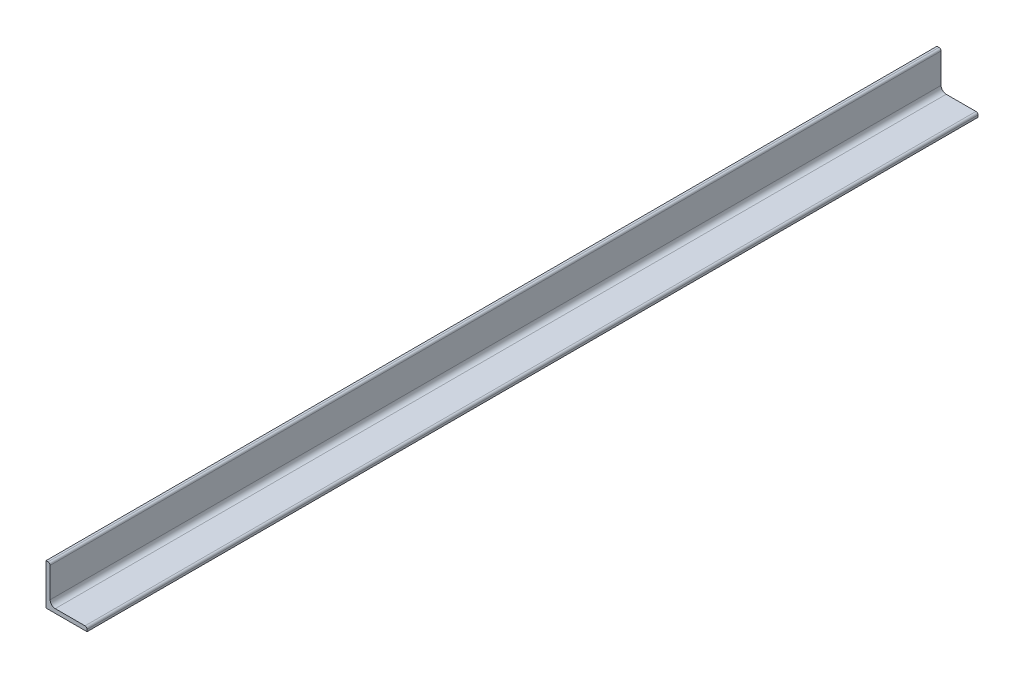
SolidWorks part; units mm, degrees
ref_plane "前视基准面" through (0, 0, 0) normal (0, 0, 1) x (1, 0, 0)
ref_plane "上视基准面" through (0, 0, 0) normal (0, 1, 0) x (1, 0, 0)
ref_plane "右视基准面" through (0, 0, 0) normal (1, 0, 0) x (0, 0, -1)
sketch "草图1" plane through (0, 0, 0) normal (0, 0, 1) x (1, 0, 0)
  line L0 (0, 40) -> (0, 0)
  line L1 (0, 0) -> (40, 0)
  line L2 (40, 0) -> (40, 2)
  line L3 (38, 4) -> (9, 4)
  line L4 (4, 9) -> (4, 38)
  line L5 (2, 40) -> (0, 40)
  arc A0 (9, 4) -> (4, 9) centre (9, 9) cw
  arc A1 (4, 38) -> (2, 40) centre (2, 38) ccw
  arc A2 (40, 2) -> (38, 4) centre (38, 2) ccw
  point P11 (4, 40)
  dimension "D6" = 5
  dimension "D7" = 2
  dimension "D1" = 40
  dimension "D2" = 40
  dimension "D3" = 4
  dimension "D4" = 4
  dimension "D5" = 4
extrude "拉伸1" add sketch "草图1" along normal blind 868
